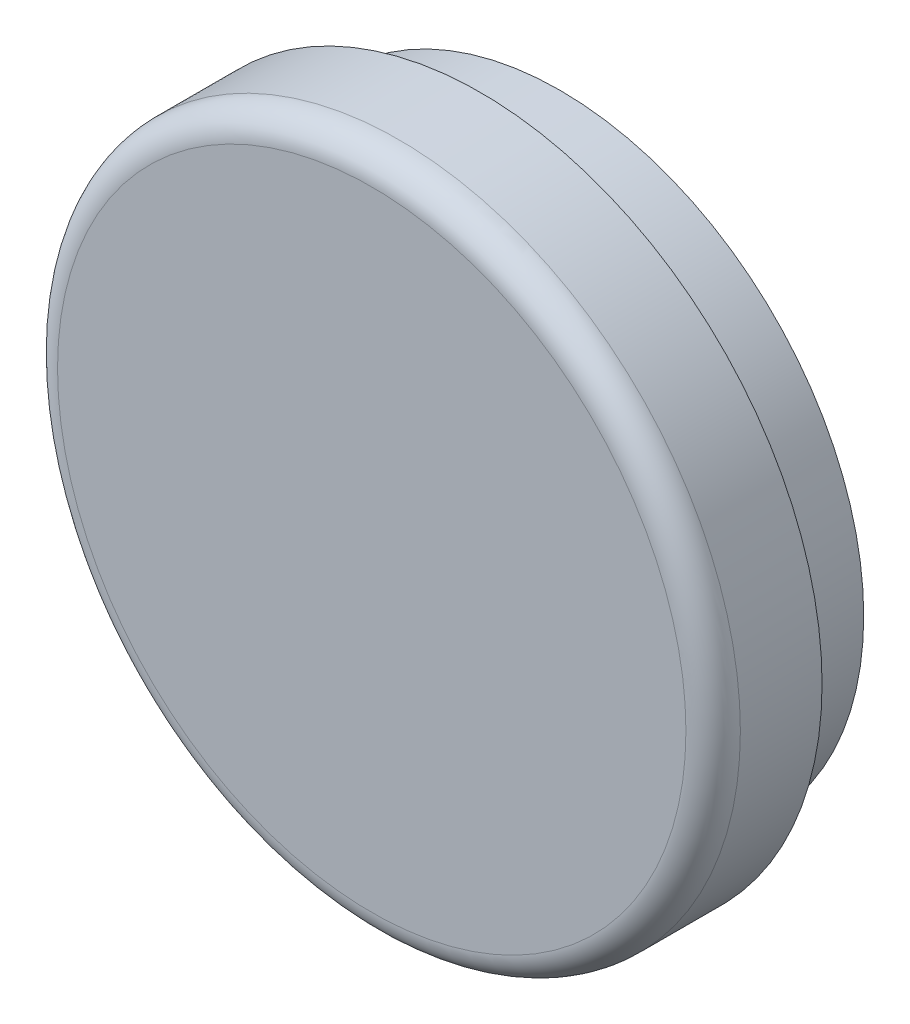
SolidWorks part; units mm, degrees
ref_plane "Front Plane" through (0, 0, 0) normal (0, 0, 1) x (1, 0, 0)
ref_plane "Top Plane" through (0, 0, 0) normal (0, 1, 0) x (1, 0, 0)
ref_plane "Right Plane" through (0, 0, 0) normal (1, 0, 0) x (0, 0, -1)
sketch "Sketch2" plane through (0, 0, 0) normal (0, 1, 0) x (1, 0, 0)
  line L0 (0, 0) -> (0, 36.83)
  line L1 (0, 36.83) -> (65.7225, 36.83)
  line L2 (65.7225, 36.83) -> (65.7225, 41.275)
  line L3 (65.7225, 41.275) -> (70.8025, 43.942)
  line L4 (70.8025, 43.942) -> (70.8025, 25.4)
  line L5 (79.629, 0) -> (0, 0)
  line L6 (70.8025, 25.4) -> (79.629, 25.4)
  line L7 (79.629, 25.4) -> (79.629, 0)
  dimension "D1" = 8.8265
  dimension "D2" = 70.8025
  dimension "D3" = 5.08
  dimension "D4" = 7.112
  dimension "D5" = 36.83
  dimension "D6" = 25.4
  dimension "D7" = 4.445
revolve "Revolve1" add sketch "Sketch2" angle 360 about L0
fillet "Fillet1" radius 6.35 1 edges at (79.629, 0, 0)
sketch "Sketch3" plane through (0, 0, -36.83) normal (0, 0, -1) x (-1, 0, 0)
  line L0 (-50.8, 0) -> (0, 50.8) construction
  line L1 (0, 50.8) -> (50.8, 0) construction
  line L2 (50.8, 0) -> (0, -50.8) construction
  line L3 (0, -50.8) -> (-50.8, 0) construction
  line L4 (0, 50.8) -> (0, -50.8) construction
  line L5 (-50.8, 0) -> (50.8, 0) construction
  circle A0 centre (0, 50.8) radius 1.5875
  circle A1 centre (50.8, 0) radius 1.5875
  circle A2 centre (0, -50.8) radius 1.5875
  circle A3 centre (-50.8, 0) radius 1.5875
  point P8 (0, 0)
  dimension "D2" = 3.175
  dimension "D1" = 101.6
extrude "Cut-Extrude1" cut sketch "Sketch3" against normal blind 6.35
